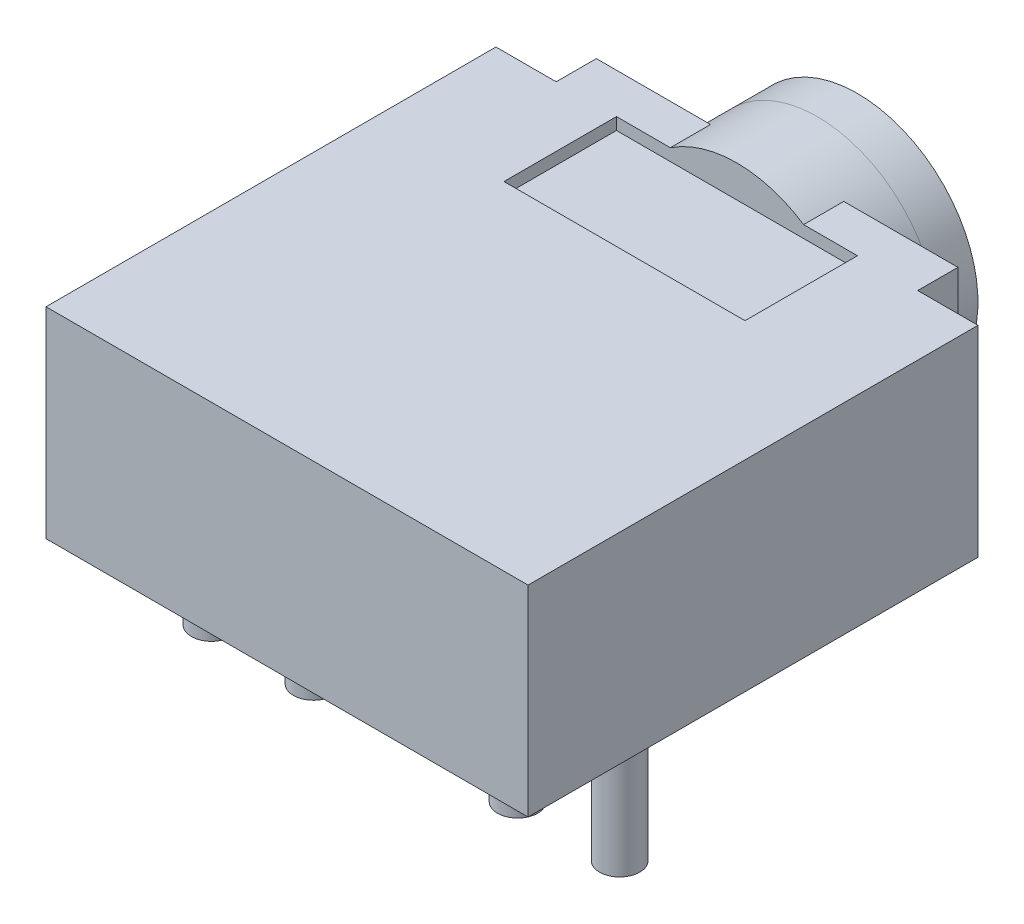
SolidWorks part; units mm, degrees
ref_plane "Plan de face" through (0, 0, 0) normal (0, 0, 1) x (1, 0, 0)
ref_plane "Plan de dessus" through (0, 0, 0) normal (0, 1, 0) x (1, 0, 0)
ref_plane "Plan de droite" through (0, 0, 0) normal (1, 0, 0) x (0, 0, -1)
sketch "Esquisse2" plane through (0, 0, 0) normal (0, 1, 0) x (1, 0, 0)
  line L0 (-26.5307, 0) -> (15.76, 0) construction
  line L1 (0, -13.1531) -> (0, 26.4246) construction
  line L2 (-6, -1.6309) -> (-6, 14.6257) construction
  line L3 (-14.1936, 11.2) -> (2.8301, 11.2) construction
  line L4 (-4.5, 14.6257) -> (-4.5, 9.6009) construction
  line L5 (-14.1936, 12.2) -> (2.8301, 12.2) construction
  line L6 (4.5, 12.2) -> (-4.5, 12.2)
  line L7 (-4.5, 12.2) -> (-4.5, 11.2)
  line L8 (-4.5, 11.2) -> (-6, 11.2)
  line L9 (-6, 11.2) -> (-6, 0)
  line L10 (-6, 0) -> (6, 0)
  line L11 (6, 11.2) -> (6, 0)
  line L12 (4.5, 12.2) -> (4.5, 11.2)
  line L13 (4.5, 11.2) -> (6, 11.2)
  point P19 (0, 0)
  point P22 (0, 12.2)
  dimension "D1" = 6
  dimension "D2" = 11.2
  dimension "D3" = 1
  dimension "D4" = 1.5
extrude "Extrusion1" add sketch "Esquisse2" along normal blind 5
sketch "Esquisse3" plane through (0, 5, 0) normal (0, 1, 0) x (-1, 0, 0)
  line L0 (6.9861, -11.2) -> (-6.9563, -11.2) construction
  line L1 (4.5, -12.6099) -> (4.5, -6.1967) construction
  line L2 (3, -12.6099) -> (3, -6.1967) construction
  line L3 (-4.5, -12.7587) -> (-4.5, -6.1967) construction
  line L4 (-3, -12.7587) -> (-3, -6.1967) construction
  line L5 (4.2036, -8.4) -> (-4.2036, -8.4) construction
  line L7 (3, -11.2) -> (-3, -11.2)
  line L8 (3, -11.2) -> (3, -8.4)
  line L9 (3, -8.4) -> (-3, -8.4)
  line L10 (-3, -11.2) -> (-3, -8.4)
  dimension "D1" = 1.5
  dimension "D2" = 1.5
  dimension "D3" = 2.8
extrude "Enlèv. mat.-Extru.1" cut sketch "Esquisse3" against normal blind 0.3
sketch "Esquisse5" plane through (0, 0, -11.2) normal (0, 0, -1) x (-1, 0, 0)
  line L0 (0, -2.3125) -> (0, 9.7065) construction
  line L1 (6.6039, 5) -> (-7.6299, 5) construction
  line L2 (-7.6299, 2.5) -> (6.6039, 2.5) construction
  circle A0 centre (0, 2.5) radius 3
  dimension "D1" = 2.5
extrude "Extrusion2" add sketch "Esquisse5" along normal blind 2
sketch "Esquisse6" plane through (0, 0, -13.2) normal (0, 0, -1) x (-1, 0, 0)
  line L0 (0, -1.4075) -> (0, 7.595) construction
  line L1 (-6.4408, 5) -> (6.7349, 5) construction
  line L2 (-6.4408, 2.5) -> (6.9724, 2.5) construction
  circle A0 centre (0, 2.5) radius 2.999
  dimension "D1" = 2.5
extrude "Extrusion3" add sketch "Esquisse6" along normal blind 1
sketch "Esquisse7" plane through (0, 0, -14.2) normal (0, 0, -1) x (-1, 0, 0)
  line L0 (0, -1.8493) -> (0, 5.7634) construction
  line L1 (-6.5438, 2.5) -> (6.2723, 2.5) construction
  line L2 (6.3359, 5) -> (-6.5438, 5) construction
  circle A0 centre (0, 2.5) radius 1.75
  dimension "D1" = 2.5
extrude "Enlèv. mat.-Extru.2" cut sketch "Esquisse7" against normal blind 10
sketch "Esquisse8" plane through (0, 0, 0) normal (0, -1, 0) x (1, 0, 0)
  line L0 (-8.1314, -11.2) -> (9.1878, -11.2) construction
  line L1 (-8.1314, -3.2) -> (9.1878, -3.2) construction
  line L2 (0, 0.7543) -> (0, -14.8677) construction
  line L3 (-5.08, 1.3556) -> (-5.08, -4.3085) construction
  line L4 (-2.54, 2.4337) -> (-2.54, -4.3085) construction
  line L5 (-6, 2.4337) -> (-6, -12.5815) construction
  line L6 (-6.6765, -8.28) -> (3.5764, -8.28) construction
  circle A0 centre (-5.08, -3.2) radius 0.5
  circle A1 centre (-2.54, -3.2) radius 0.5
  circle A2 centre (0, -8.28) radius 0.5
  circle A3 centre (5.08, -3.2) radius 0.5
  circle A4 centre (2.54, -3.2) radius 0.5
  dimension "D1" = 8
  dimension "D2" = 5.08
  dimension "D3" = 2.54
  dimension "D4" = 2.54
extrude "Extrusion4" add sketch "Esquisse8" along normal blind 3
